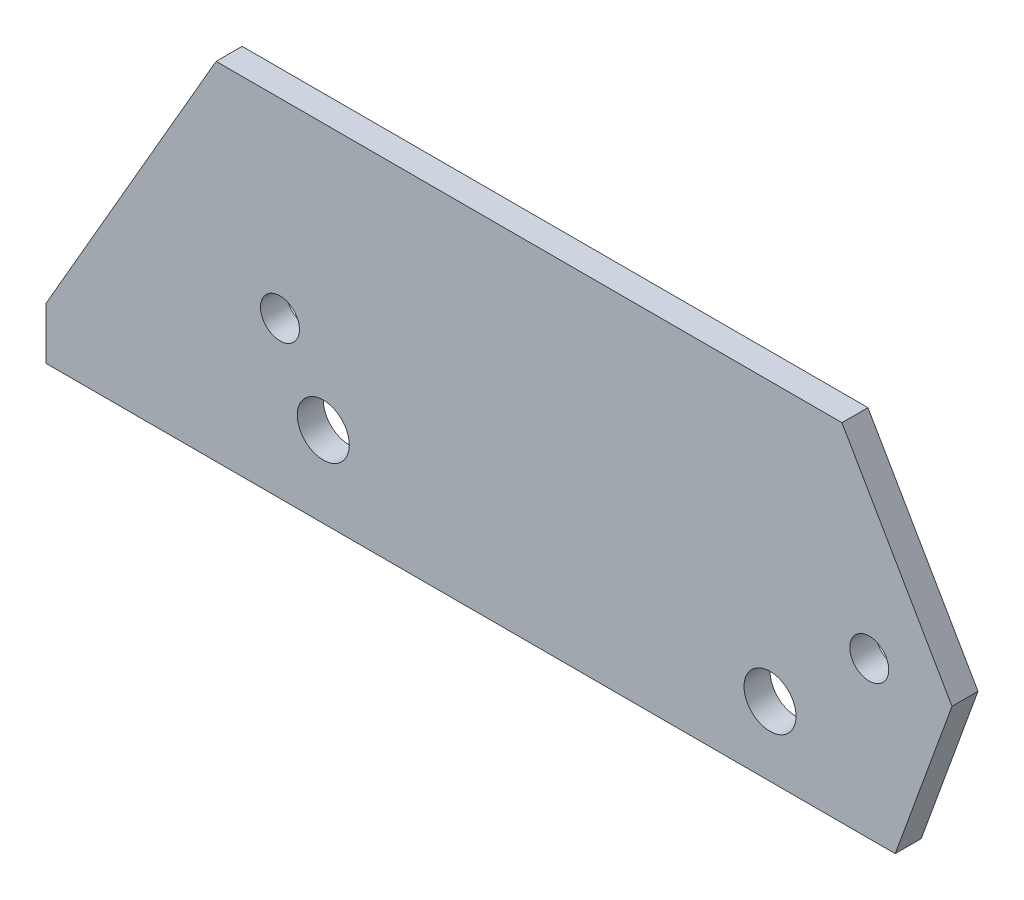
SolidWorks part; units mm, degrees
ref_plane "Front Plane" through (0, 0, 0) normal (0, 0, 1) x (1, 0, 0)
ref_plane "Top Plane" through (0, 0, 0) normal (0, 1, 0) x (1, 0, 0)
ref_plane "Right Plane" through (0, 0, 0) normal (1, 0, 0) x (0, 0, -1)
sketch "Sketch1" plane through (0, 0, 0) normal (0, 0, 1) x (1, 0, 0)
  line L0 (0, 0) -> (0, 6)
  line L1 (0, 6) -> (19.6299, 40)
  line L2 (19.6299, 40) -> (91.8498, 40)
  line L3 (91.8498, 40) -> (104.5515, 18)
  line L4 (104.5515, 18) -> (98, 0)
  line L5 (98, 0) -> (0, 0)
  line L6 (37.3923, 0) -> (23.1799, 24.6166) construction
  circle A0 centre (27, 18) radius 2.25
  circle A1 centre (32, 9.3397) radius 3
  circle A2 centre (95, 18) radius 2.25
  circle A3 centre (83.5515, 8) radius 3
  dimension "D8" = 4.5
  dimension "D9" = 6
  dimension "D10" = 6
  dimension "D11" = 4.5
  dimension "D13" = 27
  dimension "D14" = 10
  dimension "D15" = 18
  dimension "D16" = 8
  dimension "D17" = 21
  dimension "D18" = 18
  dimension "D19" = 68
  dimension "D1" = 98
  dimension "D2" = 120
  dimension "D3" = 120
  dimension "D4" = 110
  dimension "D5" = 18
  dimension "D6" = 40
  dimension "D7" = 6
  dimension "D12" = 60
extrude "Extrude1" add sketch "Sketch1" along normal blind 3
